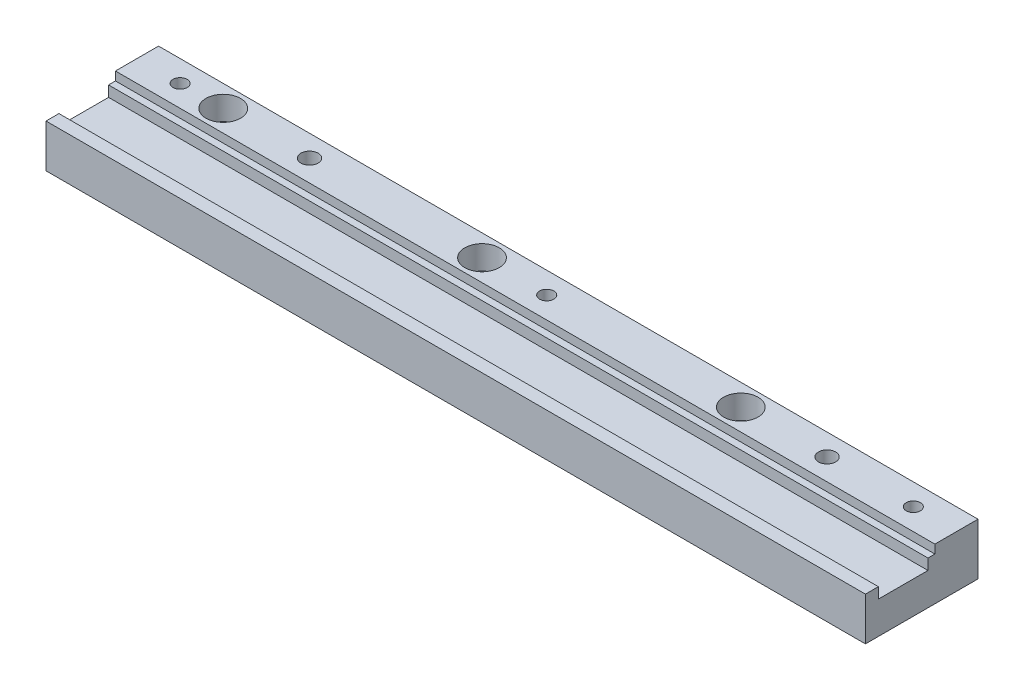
SolidWorks part; units mm, degrees
ref_plane "前视基准面" through (0, 0, 0) normal (0, 0, 1) x (1, 0, 0)
ref_plane "上视基准面" through (0, 0, 0) normal (0, 1, 0) x (1, 0, 0)
ref_plane "右视基准面" through (0, 0, 0) normal (1, 0, 0) x (0, 0, -1)
sketch "草图1" plane through (0, 0, 0) normal (0, 0, 1) x (1, 0, 0)
  line L0 (0, 0) -> (0, 12)
  line L1 (190, 0) -> (190, 12)
  line L2 (0, 0) -> (190, 0)
  line L3 (0, 12) -> (190, 12)
extrude "凸台-拉伸1" add sketch "草图1" along normal blind 26.1
sketch "草图2" plane through (190, 0, 0) normal (1, 0, 0) x (0, 0, -1)
  line L0 (-23.1, 7.5) -> (-11.6, 7.5)
  line L1 (-11.6, 10) -> (-10, 10)
  line L2 (-26.1, 10) -> (-23.1, 10)
  line L3 (-10, 10) -> (-10, 12)
  line L4 (-11.6, 7.5) -> (-11.6, 10)
  line L5 (-23.1, 7.5) -> (-23.1, 10)
  line L6 (-26.1, 0) -> (0, 0)
  line L7 (0, 0) -> (0, 12)
  line L8 (-26.1, 0) -> (-26.1, 10)
  line L9 (-10, 12) -> (0, 12)
extrude "切除-拉伸1" cut sketch "草图2" against normal through all flip side to cut
sketch "草图3" plane through (0, 12, 0) normal (0, 1, 0) x (1, 0, 0)
  circle A0 centre (140, -5) radius 2.25
  circle A1 centre (20, -5) radius 2.25
  circle A2 centre (80, -5) radius 2.25
  circle A3 centre (10, -5) radius 1.65
  circle A4 centre (95, -5) radius 1.65
  circle A5 centre (180, -5) radius 1.65
  circle A6 centre (160, -5) radius 2
  circle A7 centre (40, -5) radius 2
extrude "切除-拉伸2" cut sketch "草图3" against normal blind 26.1
sketch "草图4" plane through (0, 12, 0) normal (0, 1, 0) x (1, 0, 0)
  circle A0 centre (140, -5) radius 4
  circle A1 centre (20, -5) radius 4
  circle A2 centre (80, -5) radius 4
extrude "切除-拉伸3" cut sketch "草图4" against normal blind 5.5
